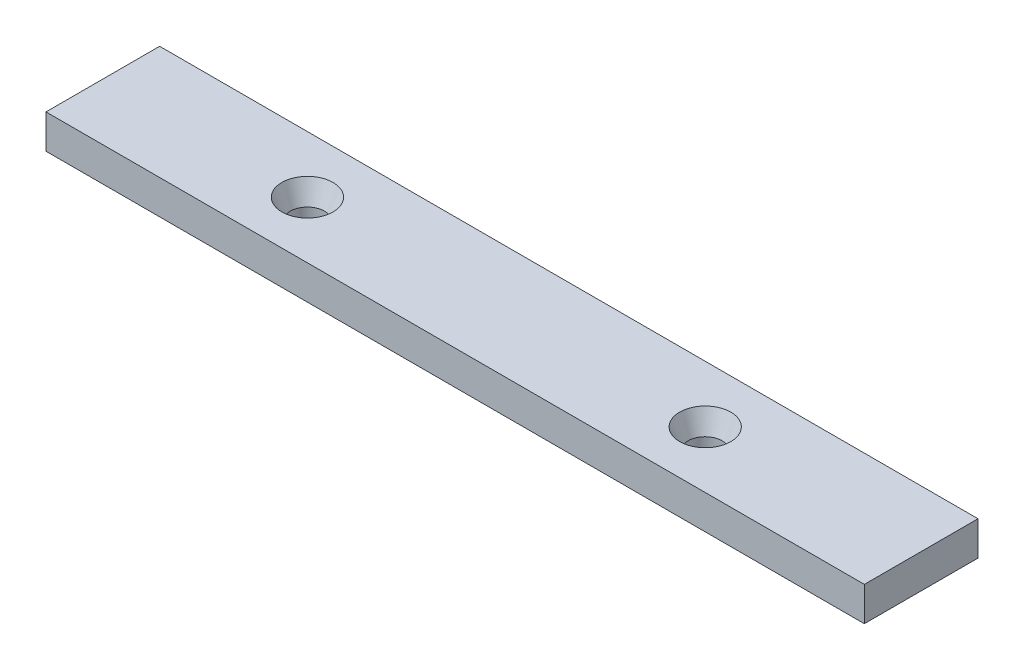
SolidWorks part; units mm, degrees
ref_plane "Front Plane" through (0, 0, 0) normal (0, 0, 1) x (1, 0, 0)
ref_plane "Top Plane" through (0, 0, 0) normal (0, 1, 0) x (1, 0, 0)
ref_plane "Right Plane" through (0, 0, 0) normal (1, 0, 0) x (0, 0, -1)
sketch "Sketch1" plane through (0, 0, 0) normal (0, 1, 0) x (1, 0, 0)
  line L1 (-72, -10) -> (72, -10)
  line L2 (-72, -10) -> (-72, 10)
  line L3 (-72, 10) -> (72, 10)
  line L4 (72, -10) -> (72, 10)
  line L5 (-72, -10) -> (72, 10) construction
  line L6 (-72, 10) -> (72, -10) construction
  point P0 (0, 0)
  dimension "D1" = 144
  dimension "D2" = 20
extrude "Boss-Extrude1" add sketch "Sketch1" along normal blind 6
hole_wizard "CSK for M6 Flat Head Machine Screw1" positions "Sketch3" profile "Sketch2" countersink size "M6" standard "Ansi Metric"
sketch "Sketch3" plane through (0, 6, 0) normal (0, 1, 0) x (-1, 0, 0)
  line L0 (-72, 10) -> (-72, -10) construction
  point P0 (36, 0)
  point P1 (-34, 0)
  dimension "D1" = 70
  dimension "D2" = 38
sketch "Sketch2" plane through (-36, 6, 0) normal (1, 0, 0) x (0, 0, 1)
  line L0 (0, 0) -> (0, 6)
  line L1 (0, 6) -> (3, 6)
  line L2 (3, 6) -> (3, 3.6213)
  line L3 (3, 3.6213) -> (4.5, 0)
  line L5 (4.5, 0) -> (0, 0)
  line L6 (-3, 3.6213) -> (-4.5, 0) construction
  line L11 (0, -6.35) -> (0, 107.95) construction
  dimension "Thru Hole Dia." = 6
  dimension "Thru Hole Depth" = 6
  dimension "Near C'Sink Dia." = 9
  dimension "Near C'Sink Angle" = 45
